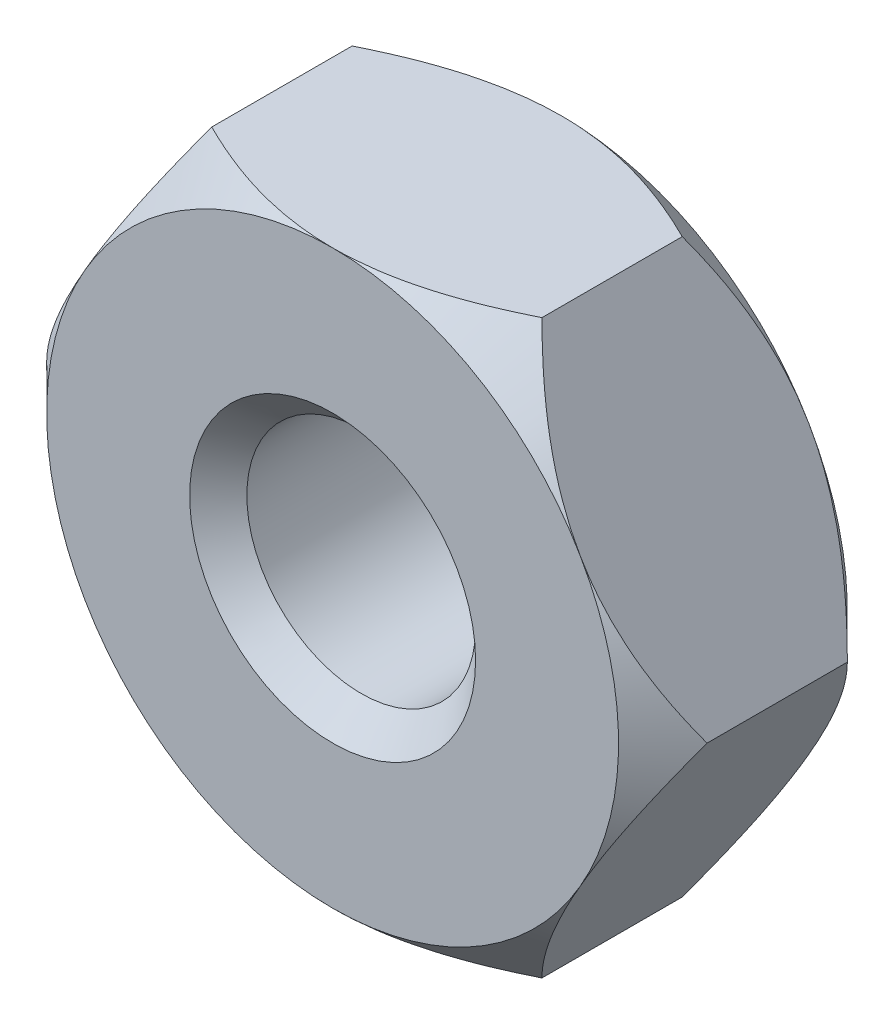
SolidWorks part; units mm, degrees
ref_plane "Ebene vorne" through (0, 0, 0) normal (0, 0, 1) x (1, 0, 0)
ref_plane "Ebene oben" through (0, 0, 0) normal (0, 1, 0) x (1, 0, 0)
ref_plane "Ebene rechts" through (0, 0, 0) normal (1, 0, 0) x (0, 0, -1)
sketch "Skizze1" plane through (0, 0, 0) normal (0, 0, 1) x (1, 0, 0)
  line L1 (2.3094, 0) -> (1.1547, 2)
  line L2 (1.1547, 2) -> (-1.1547, 2)
  line L3 (-1.1547, 2) -> (-2.3094, 0)
  line L4 (-2.3094, 0) -> (-1.1547, -2)
  line L5 (-1.1547, -2) -> (1.1547, -2)
  line L6 (1.1547, -2) -> (2.3094, 0)
  circle A0 centre (0, 0) radius 2 construction
  dimension "Schlüsselbreite" = 4
extrude "Aufsatz-Linear austragen1" add sketch "Skizze1" along normal mid plane 1.6
sketch "Skizze2" plane through (0, 0, 0.8) normal (0, 0, 1) x (1, 0, 0)
  line L0 (1.1547, 2) -> (-1.1547, 2) construction
  circle A0 centre (0, 0) radius 2
extrude "Schnitt-Linear austragen1" cut sketch "Skizze2" against normal through all draft 45 flip side to cut
mirror "Spiegeln1" about plane through (0, 0, 0) normal (0, 0, 1) of "Schnitt-Linear austragen1"
hole_wizard " Gewindebohrung1" positions "Skizze3" profile "Skizze4" tap size "M2" standard "ISO"
sketch "Skizze3" plane through (0, 0, 0.8) normal (0, 0, 1) x (1, 0, 0)
  point P0 (0, 0)
sketch "Skizze4" plane through (0, 0, 0.8) normal (1, 0, 0) x (0, -1, 0)
  line L0 (0, 0) -> (0, 1.6)
  line L1 (0, 1.6) -> (0.8, 1.6)
  line L2 (0.8, 1.6) -> (0.8, 0)
  line L5 (0.8, 0) -> (0, 0)
  line L11 (0, -6.35) -> (0, 107.95) construction
  dimension "Bohrerdurchmesser" = 1.6
  dimension "Bohrungstiefe" = 1.6
chamfer "Fase1" distance 0.2 angle 45 2 edges at (0.8, 0, -0.8) (0.8, 0, 0.8)
